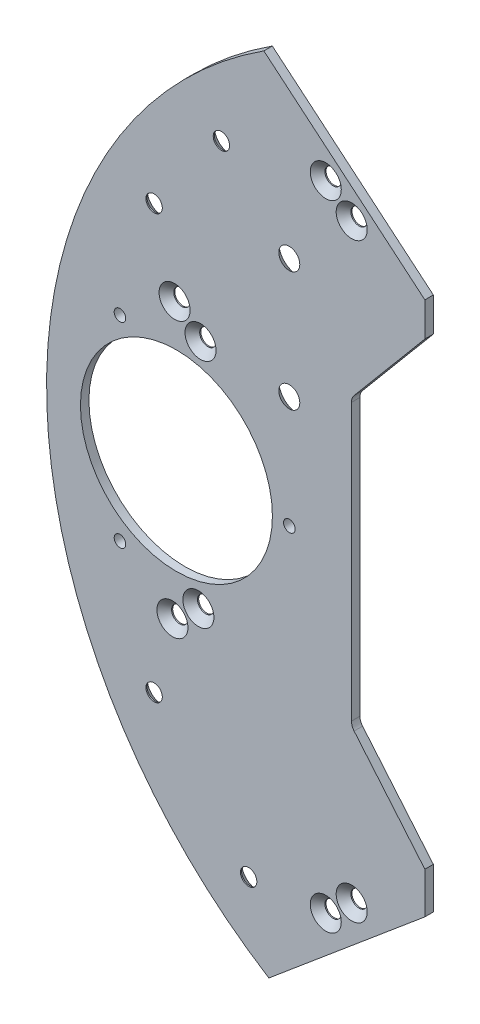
SolidWorks part; units mm, degrees
ref_plane "Plano frontal" through (0, 0, 0) normal (0, 0, 1) x (1, 0, 0)
ref_plane "Plano superior" through (0, 0, 0) normal (0, 1, 0) x (1, 0, 0)
ref_plane "Plano direito" through (0, 0, 0) normal (1, 0, 0) x (0, 0, -1)
sketch "Esboço1" plane through (0, 0, 0) normal (0, 0, 1) x (1, 0, 0)
  line L0 (-17, 85.3229) -> (-17, -85.3229)
  arc A0 (-17, 85.3229) -> (-17, -85.3229) centre (0, 0) ccw
  dimension "D1" = 174
  dimension "D2" = 17
extrude "Ressalto-extrusão1" add sketch "Esboço1" along normal blind 1.5
sketch "Esboço2" plane through (0, 0, 1.5) normal (0, 0, 1) x (1, 0, 0)
  line L0 (0, 0) -> (-61, 0) construction
  line L1 (-61, 0) -> (-41, 0) construction
  line L2 (-61, 0) -> (-71, 17.3205) construction
  line L3 (-61, 0) -> (-71, -17.3205) construction
  circle A0 centre (-61, 0) radius 17
  point P4 (-41, 0)
  dimension "D2" = 34
  dimension "D1" = 61
  dimension "D3" = 20
  dimension "D4" = 120
  dimension "D5" = 120
  dimension "D6" = 20
  dimension "D7" = 20
extrude "Corte-extrusão1" cut sketch "Esboço2" against normal blind 1.5
hole_wizard "Furo roscado de M2.51" positions "3DSketch1" profile "Esboço3" tap size "M2.5" standard "ISO"
sketch3d "3DSketch1"
  point P0 (-71, 17.3205, 1.5)
  point P3 (-41, 0, 1.5)
  point P10 (-71, -17.3205, 1.5)
sketch "Esboço3" plane through (-71, 17.3205, 1.5) normal (1, 0, 0) x (0, -1, 0)
  line L0 (0, 0) -> (0, 1.5)
  line L1 (0, 1.5) -> (1.025, 1.5)
  line L2 (1.025, 1.5) -> (1.025, 0)
  line L5 (1.025, 0) -> (0, 0)
  line L11 (0, -6.35) -> (0, 107.95) construction
  dimension "Thru Tap Drill Dia." = 2.05
  dimension "Thru Tap Drill Depth" = 1.5
sketch "Esboço6" plane through (0, 0, 1.5) normal (0, 0, 1) x (1, 0, 0)
  line L0 (0, 0) -> (-61, 0) construction
  line L1 (0, 0) -> (-66.6459, 55.9225) construction
  line L2 (0, 0) -> (-66.6459, -55.9225) construction
  line L3 (-30, -24.445) -> (-30, 24.445)
  line L4 (-29.5321, 25.7306) -> (-17, 40.6658)
  line L5 (-29.5321, -25.7306) -> (-17, -40.6658)
  line L6 (-17, 40.6658) -> (-17, -40.6658)
  line L7 (-17, -85.3229) -> (-17, 85.3229) construction
  arc A0 (-17, 85.3229) -> (-17, -85.3229) centre (0, 0) ccw construction
  arc A1 (-30, -24.445) -> (-29.5321, -25.7306) centre (-28, -24.445) ccw
  arc A2 (-30, 24.445) -> (-29.5321, 25.7306) centre (-28, 24.445) cw
  point P4 (-30, 0)
  point P13 (-30, 0)
  point P21 (-30, 25.173)
  dimension "D4" = 2
  dimension "D1" = 40
  dimension "D2" = 40
  dimension "D3" = 30
extrude "Corte-extrusão3" cut sketch "Esboço6" against normal blind 1.5
sketch "Esboço7" plane through (0, 0, 1.5) normal (0, 0, 1) x (1, 0, 0)
  line L0 (0, 0) -> (0, 87) construction
  line L1 (-17, 80) -> (0, 80) construction
  line L2 (-17, 40.6658) -> (-17, 85.3229) construction
  line L3 (-27.5, 80) -> (-34.1906, 80)
  line L4 (-34.1906, 80) -> (-34.1906, 87)
  line L5 (-34.1906, 87) -> (-17, 87)
  line L6 (-27.5, 80) -> (-27.5, 55)
  line L7 (-27.5, 55) -> (-17, 55)
  line L8 (-17, 55) -> (-17, 87)
  line L9 (-17, 80) -> (-27.5, 80) construction
  line L10 (-17, 55) -> (0, 55) construction
  line L11 (-17, 87) -> (0, 87) construction
  arc A0 (-17, 85.3229) -> (-17, -85.3229) centre (0, 0) ccw construction
  point P3 (0, 80)
  dimension "D1" = 87
  dimension "D2" = 80
  dimension "D3" = 25
  dimension "D4" = 27.5
sketch "Esboço9" plane through (0, 0, 1.5) normal (0, 0, 1) x (1, 0, 0)
  line L0 (0, 0) -> (-66.6459, 55.9225) construction
  line L1 (0, 0) -> (-62.0797, 0) construction
  line L2 (0, 0) -> (-66.6459, -55.9225) construction
  line L3 (-80.0319, 39.9696) -> (-53.2598, 71.8754) construction
  line L4 (-77.3347, 37.7064) -> (-50.5626, 69.6122) construction
  line L5 (-80.0319, 39.9696) -> (-77.3347, 37.7064) construction
  line L6 (-50.5626, 69.6122) -> (-53.2598, 71.8754) construction
  line L7 (-77.3347, 37.7064) -> (-61.3244, 24.2722) construction
  line L8 (-50.5626, 69.6122) -> (-34.5523, 56.1779) construction
  line L9 (-61.3244, 24.2722) -> (-56.7281, 20.4154) construction
  line L10 (-34.5523, 56.1779) -> (-29.956, 52.3212) construction
  line L11 (-80.0319, -39.9696) -> (-53.2598, -71.8754) construction
  line L12 (-53.2598, -71.8754) -> (-50.5626, -69.6122) construction
  line L13 (-50.5626, -69.6122) -> (-77.3347, -37.7064) construction
  line L14 (-77.3347, -37.7064) -> (-80.0319, -39.9696) construction
  line L15 (-77.3347, -37.7064) -> (-57.1111, -20.7368) construction
  line L16 (-50.5626, -69.6122) -> (-29.956, -52.3212)
  line L17 (-80.0319, -39.9696) -> (-82.3942, -37.1544) construction
  line L18 (-53.2598, -71.8754) -> (-50.8976, -74.6906) construction
  line L19 (-50.8976, -74.6906) -> (-48.2004, -72.4274) construction
  line L20 (-48.2004, -72.4274) -> (-50.5626, -69.6122) construction
  line L21 (-82.3942, -37.1544) -> (-79.697, -34.8912) construction
  line L22 (-79.697, -34.8912) -> (-77.3347, -37.7064) construction
  line L23 (-80.0319, 39.9696) -> (-82.3942, 37.1544) construction
  line L24 (-82.3942, 37.1544) -> (-79.697, 34.8912) construction
  line L25 (-79.697, 34.8912) -> (-77.3347, 37.7064) construction
  line L26 (-53.2598, 71.8754) -> (-50.8976, 74.6906) construction
  line L27 (-50.8976, 74.6906) -> (-48.2004, 72.4274) construction
  line L28 (-48.2004, 72.4274) -> (-50.5626, 69.6122) construction
  arc A0 (-17, 85.3229) -> (-17, -85.3229) centre (0, 0) ccw construction
  point P11 (-66.6459, 55.9225)
  point P14 (-63.9487, 53.6593)
  point P15 (-34.5523, -56.1779)
  point P21 (-66.6459, -55.9225)
  point P26 (-61.7074, -24.5935)
  dimension "D1" = 40
  dimension "D2" = 40
  dimension "D3" = 49
  dimension "D5" = 20.9
  dimension "D6" = 6
  dimension "D7" = 6
  dimension "D8" = 49
  dimension "D9" = 20.4
  dimension "D10" = 6
  dimension "D11" = 20.9
  dimension "D12" = 6
  dimension "D13" = 41.65
  dimension "D14" = 41.65
hole_wizard "Escareado para parafuso com cabeça escareada chata de M2.51" positions "3DSketch3" profile "Esboço11" countersink size "M2.5" standard "ISO"
sketch3d "3DSketch3"
  point P0 (-61.7074, -24.5935, 1.5)
  point P3 (-57.1111, -20.7368, 1.5)
  point P6 (-29.956, -52.3212, 1.5)
  point P9 (-34.5523, -56.1779, 1.5)
  point P12 (-34.5523, 56.1779, 1.5)
  point P15 (-29.956, 52.3212, 1.5)
  point P18 (-61.3244, 24.2722, 1.5)
  point P21 (-56.7281, 20.4154, 1.5)
sketch "Esboço11" plane through (-61.7074, -24.5935, 1.5) normal (1, 0, 0) x (0, -1, 0)
  line L0 (0, 0) -> (0, 1.5)
  line L1 (0, 1.5) -> (1.45, 1.5)
  line L2 (1.45, 1.5) -> (1.45, 1.3)
  line L3 (1.45, 1.3) -> (2.75, 0)
  line L5 (2.75, 0) -> (0, 0)
  line L6 (-1.45, 1.3) -> (-2.75, 0) construction
  line L11 (0, -6.35) -> (0, 107.95) construction
  dimension "Thru Hole Dia." = 2.9
  dimension "Thru Hole Depth" = 1.5
  dimension "Near C'Sink Dia." = 5.5
  dimension "Near C'Sink Angle" = 90
sketch "Esboço13" plane through (0, 0, 0) normal (0, 0, -1) x (-1, 0, 0)
  line L0 (0, 0) -> (64.9519, 37.5) construction
  line L1 (0, 0) -> (64.9519, -37.5) construction
  line L2 (0, 0) -> (48.2091, -57.4533) construction
  line L3 (0, 0) -> (53.033, 53.033) construction
  line L4 (0, 0) -> (78, 0) construction
  circle A1 centre (61, 0) radius 17 construction
  dimension "D1" = 45
  dimension "D2" = 50
  dimension "D5" = 75
  dimension "D7" = 30
  dimension "D8" = 30
hole_wizard "Escareado para parafuso com cabeça escareada chata de M2.53" positions "3DSketch6" profile "Esboço16" countersink size "M2.5" standard "ISO"
sketch3d "3DSketch6"
  point P0 (-48.2091, -57.4533, 0)
  point P3 (-64.9519, -37.5, 0)
  point P6 (-64.9519, 37.5, 0)
  point P9 (-53.033, 53.033, 0)
sketch "Esboço16" plane through (-48.2091, -57.4533, 0) normal (1, 0, 0) x (0, 1, 0)
  line L0 (0, 0) -> (0, 8.1212)
  line L1 (0, 8.1212) -> (1.45, 7.25)
  line L2 (1.45, 7.25) -> (1.45, 1.3)
  line L3 (1.45, 1.3) -> (2.75, 0)
  line L5 (2.75, 0) -> (0, 0)
  line L6 (-1.45, 1.3) -> (-2.75, 0) construction
  line L10 (0, 8.1212) -> (-1.45, 7.25) construction
  line L11 (0, -6.35) -> (0, 107.95) construction
  dimension "Hole Dia." = 2.9
  dimension "Hole Depth" = 7.25
  dimension "Near C'Sink Dia." = 5.5
  dimension "Near C'Sink Angle" = 90
  dimension "Drill Angle" = 118
sketch "Esboço17" plane through (0, 0, 0) normal (0, 0, -1) x (-1, 0, 0)
  line L0 (0, 0) -> (44, 0) construction
  line L1 (0, 0) -> (41.0122, 41.0122) construction
  line L7 (19.799, 41.0122) -> (41.0122, 19.799) construction
  circle A0 centre (61, 0) radius 17 construction
  point P11 (30.4056, 30.4056)
  dimension "D1" = 45
  dimension "D2" = 58
  dimension "D3" = 30
  dimension "D4" = 15
sketch "Esboço19" plane through (0, 0, 0) normal (0, 0, -1) x (-1, 0, 0)
  line L0 (29.956, 52.3212) -> (34.5523, 56.1779) construction
  line L1 (34.5523, 56.1779) -> (31.9811, 59.2421) construction
  line L2 (31.9811, 59.2421) -> (17, 46.6714)
  line L3 (17, 40.6658) -> (17, 85.3229) construction
  line L4 (17, 46.6714) -> (17, 85.3229)
  line L5 (17, 85.3229) -> (63.063, 85.3229)
  line L6 (63.063, 85.3229) -> (31.9811, 59.2421)
  line L7 (29.956, -52.3212) -> (34.5523, -56.1779) construction
  line L8 (34.5523, -56.1779) -> (31.3383, -60.0081) construction
  line L9 (31.3383, -60.0081) -> (17, -47.9768)
  line L10 (17, -85.3229) -> (17, -40.6658) construction
  line L11 (17, -47.9768) -> (17, -85.3229)
  line L12 (17, -85.3229) -> (61.5073, -85.3229)
  line L13 (61.5073, -85.3229) -> (31.3383, -60.0081)
  dimension "D1" = 4
  dimension "D2" = 5
extrude "Corte-extrusão7" cut sketch "Esboço19" against normal through all
sketch "Esboço20" plane through (0, 0, 0) normal (0, 0, -1) x (-1, 0, 0)
  line L0 (17, 46.6714) -> (47.9179, 72.6146) construction
  line L1 (17, -47.9768) -> (47.042, -73.1851) construction
  line L2 (47.9179, 72.6146) -> (45.5162, 70.5994)
  line L3 (44.6312, -71.1622) -> (47.042, -73.1851)
  arc A0 (47.042, -73.1851) -> (47.9179, 72.6146) centre (0, 0) ccw
  arc A1 (44.6312, -71.1622) -> (45.5162, 70.5994) centre (0, 0) ccw
  dimension "D1" = 84
extrude "Corte-extrusão8" cut sketch "Esboço20" against normal through all
hole_wizard "Escareado para parafuso Allen sextavado escareado de M31" positions "3DSketch7" profile "Esboço21" countersink size "M3" standard "ISO"
sketch3d "3DSketch7"
  point P3 (-41.0122, 19.799, 0)
  point P6 (-41.0122, 41.0122, 0)
sketch "Esboço21" plane through (-41.0122, 19.799, 0) normal (1, 0, 0) x (0, 1, 0)
  line L0 (0, 0) -> (0, 5.0215)
  line L1 (0, 5.0215) -> (1.7, 4)
  line L2 (1.7, 4) -> (1.7, 1.66)
  line L3 (1.7, 1.66) -> (3.36, 0)
  line L5 (3.36, 0) -> (0, 0)
  line L6 (-1.7, 1.66) -> (-3.36, 0) construction
  line L10 (0, 5.0215) -> (-1.7, 4) construction
  line L11 (0, -6.35) -> (0, 107.95) construction
  dimension "Hole Dia." = 3.4
  dimension "Hole Depth" = 4
  dimension "Near C'Sink Dia." = 6.72
  dimension "Near C'Sink Angle" = 90
  dimension "Drill Angle" = 118
